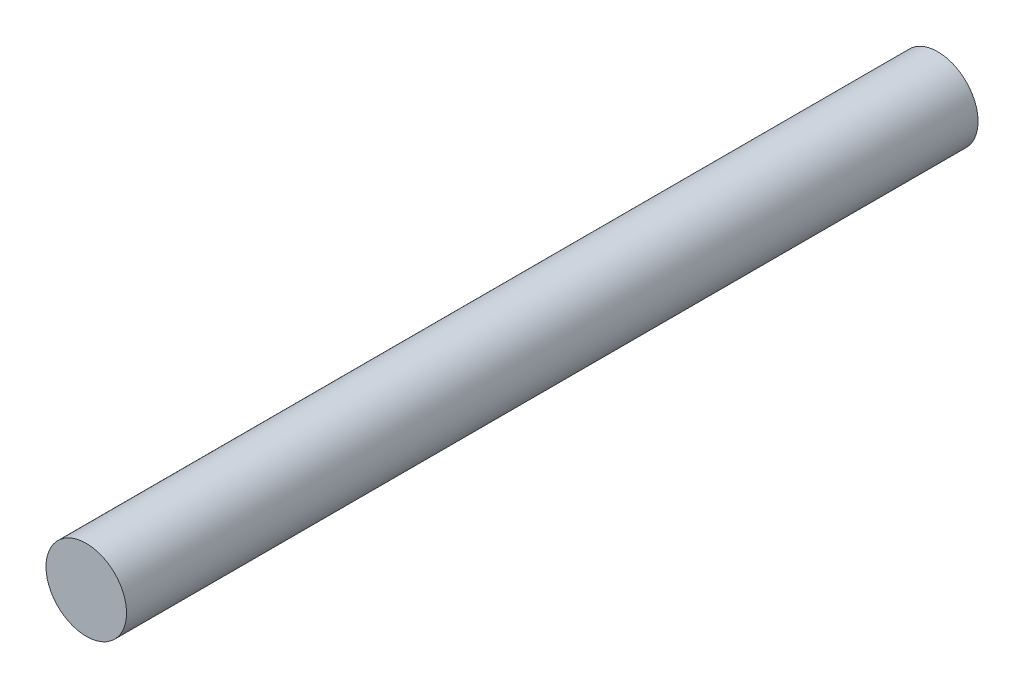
SolidWorks part; units mm, degrees
ref_plane "Front" through (0, 0, 0) normal (0, 0, 1) x (1, 0, 0)
ref_plane "Top" through (0, 0, 0) normal (0, 1, 0) x (1, 0, 0)
ref_plane "Right" through (0, 0, 0) normal (1, 0, 0) x (0, 0, -1)
sketch "Sketch1" plane through (0, 0, 0) normal (0, 0, 1) x (1, 0, 0)
  circle A0 centre (0, 0) radius 2.8829
extrude "Extrude1" add sketch "Sketch1" along normal blind 60.96
